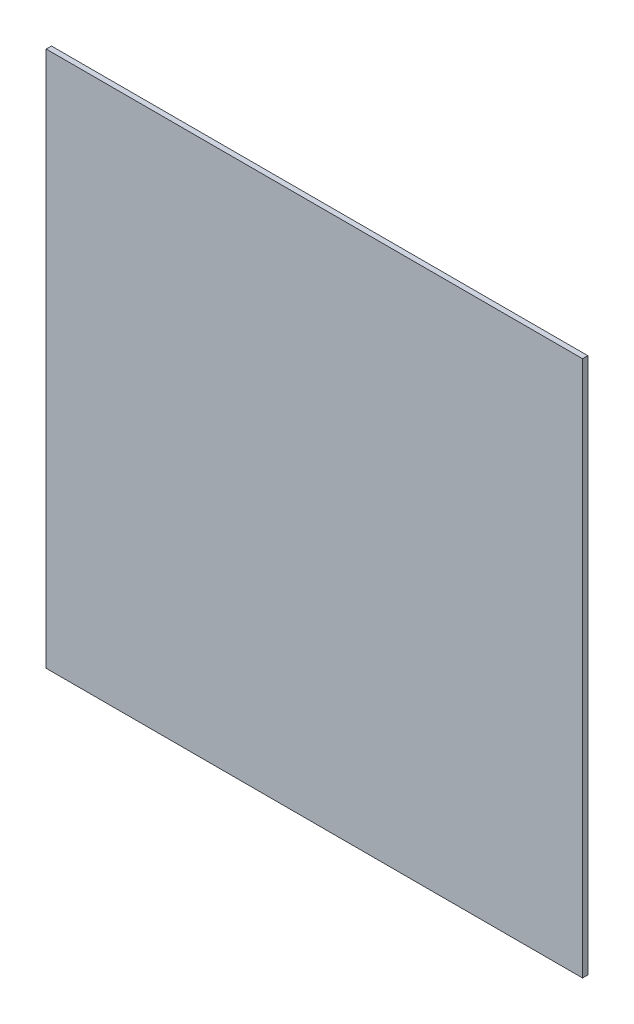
SolidWorks part; units mm, degrees
ref_plane "Front Plane" through (0, 0, 0) normal (1, 0, 0) x (0, 1, 0)
ref_plane "Top Plane" through (0, 0, 0) normal (0, 0, 1) x (0, 1, 0)
ref_plane "Right Plane" through (0, 0, 0) normal (0, 1, 0) x (-1, 0, 0)
sketch "Sketch1" plane through (0, 0, 0) normal (0, 0, 1) x (0, 1, 0)
  line L1 (-152.4, -152.4) -> (152.4, -152.4)
  line L2 (-152.4, -152.4) -> (-152.4, 152.4)
  line L3 (-152.4, 152.4) -> (152.4, 152.4)
  line L4 (152.4, -152.4) -> (152.4, 152.4)
  line L5 (-152.4, -152.4) -> (152.4, 152.4) construction
  line L6 (-152.4, 152.4) -> (152.4, -152.4) construction
  point P0 (0, 0)
  dimension "D1" = 304.8
  dimension "D2" = 304.8
extrude "Boss-Extrude1" add sketch "Sketch1" along normal blind 3 contours L2 L3 L4 L1
